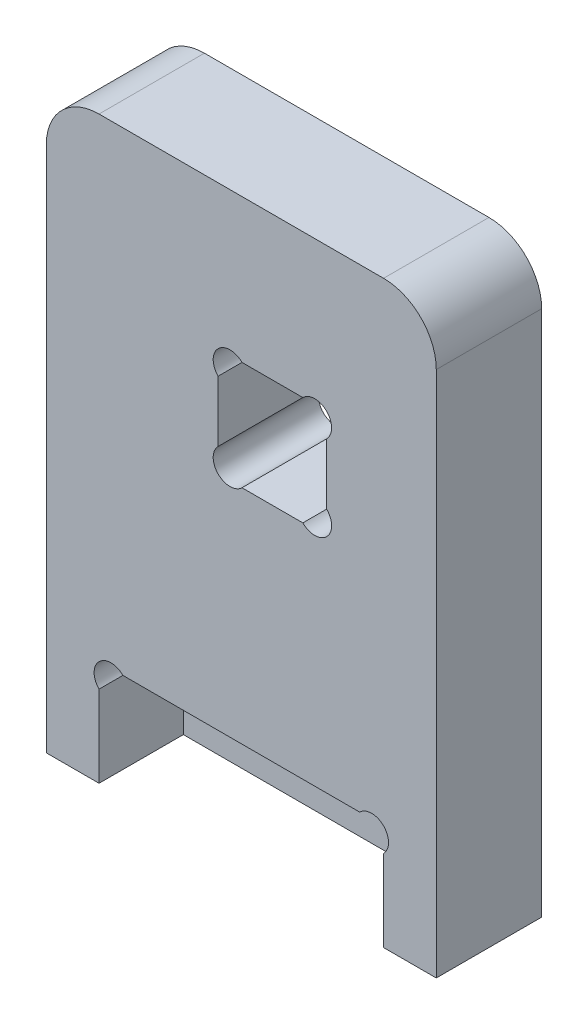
SolidWorks part; units mm, degrees
ref_plane "Plan de face" through (0, 0, 0) normal (0, 0, 1) x (1, 0, 0)
ref_plane "Plan de dessus" through (0, 0, 0) normal (0, 1, 0) x (1, 0, 0)
ref_plane "Plan de droite" through (0, 0, 0) normal (1, 0, 0) x (0, 0, -1)
sketch "Esquisse1" plane through (0, 0, 0) normal (0, 0, 1) x (1, 0, 0)
  line L0 (-2.2, 10.58) -> (1.2673, 7.1127) construction
  line L1 (-18.5, -33.0716) -> (-18.5, 48.3466) construction
  line L2 (-18.5, 24.21) -> (-18.5, -30.79)
  line L3 (-18.5, -30.79) -> (18.5, -30.79)
  line L4 (18.5, 24.21) -> (18.5, -30.79)
  line L5 (18.5, -33.0716) -> (18.5, 48.3466) construction
  line L6 (-6.133, 10.58) -> (32.7193, 10.58) construction
  line L7 (-1.0722, 0.28) -> (32.7193, 0.28) construction
  line L8 (8.1, 8.3173) -> (8.1, 2.5427)
  line L9 (5.8373, 0.28) -> (0.0627, 0.28)
  line L10 (-2.2, 8.3173) -> (-2.2, 2.5427)
  line L11 (2.95, 2.6139) -> (2.95, 15.5275) construction
  line L12 (8.0928, 5.43) -> (-10.0576, 5.43) construction
  line L13 (5.8373, 10.58) -> (0.0627, 10.58)
  line L14 (-21.4339, 24.21) -> (39.4715, 24.21) construction
  line L15 (-21.4339, -30.79) -> (39.4715, -30.79) construction
  line L16 (-18.5, 24.21) -> (18.5, 24.21)
  line L17 (8.1, 2.6139) -> (8.1, 32.6876) construction
  line L18 (-2.2, 2.6139) -> (-2.2, 32.6876) construction
  arc A0 (-2.2, 8.3173) -> (0.0627, 10.58) centre (-1.0686, 9.4486) cw
  arc A1 (8.1, 8.3173) -> (5.8373, 10.58) centre (6.9686, 9.4486) ccw
  arc A2 (8.1, 2.5427) -> (5.8373, 0.28) centre (6.9686, 1.4114) cw
  arc A3 (-2.2, 2.5427) -> (0.0627, 0.28) centre (-1.0686, 1.4114) ccw
  point P0 (0, 0)
  point P10 (-1.0686, 9.4486)
  dimension "D7" = 31.07
  dimension "D1" = 55
  dimension "D2" = 37
  dimension "D3" = 10.4
  dimension "D4" = 10.3
  dimension "D5" = 10.3
  dimension "D6" = 1.6
  dimension "D8" = 45
extrude "Boss.-Extru.1" add sketch "Esquisse1" along normal blind 10
sketch "Esquisse2" plane through (0, 0, 10) normal (0, 0, 1) x (1, 0, 0)
  line L0 (-13.5, -20.79) -> (-9.3461, -24.9439) construction
  line L1 (-22.976, -30.79) -> (19.9728, -30.79) construction
  line L2 (19.9728, -20.79) -> (-22.976, -20.79) construction
  line L3 (13.5, -35.2864) -> (13.5, -18.1568) construction
  line L4 (-13.5, -35.2864) -> (-13.5, -18.1568) construction
  line L5 (0, -28.79) -> (0, -13.9693) construction
  line L6 (18.5, -35.2864) -> (18.5, -19.6425) construction
  line L7 (18.5, -30.79) -> (18.5, 24.21) construction
  line L8 (13.5, -25.79) -> (-22.976, -25.79) construction
  line L12 (-11.2373, -20.79) -> (11.2373, -20.79)
  line L13 (-13.5, -23.0527) -> (-13.5, -30.79)
  line L14 (-13.5, -30.79) -> (13.5, -30.79)
  line L15 (13.5, -23.0527) -> (13.5, -30.79)
  arc A0 (-11.2373, -20.79) -> (-13.5, -23.0527) centre (-12.3686, -21.9214) ccw
  arc A3 (11.2373, -20.79) -> (13.5, -23.0527) centre (12.3686, -21.9214) cw
  point P0 (-12.3686, -21.9214)
  dimension "D1" = 45
  dimension "D3" = 5
  dimension "D2" = 1.6
  dimension "D4" = 5
  dimension "D5" = 5
  dimension "D6" = 27
extrude "Enlèv. mat.-Extru.1" cut sketch "Esquisse2" against normal blind 8
fillet "Congé1" radius 5 2 edges at (-18.5, 24.21, 5) (18.5, 24.21, 5)
